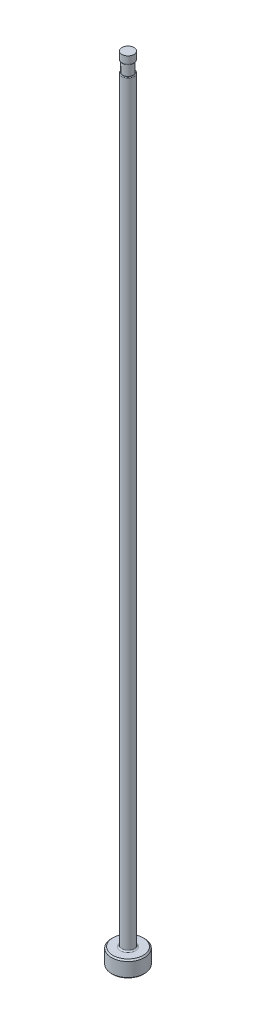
SolidWorks part; units mm, degrees
ref_plane "Front Plane" through (0, 0, 0) normal (0, 0, 1) x (1, 0, 0)
ref_plane "Top Plane" through (0, 0, 0) normal (0, 1, 0) x (1, 0, 0)
ref_plane "Right Plane" through (0, 0, 0) normal (1, 0, 0) x (0, 0, -1)
other "Configuration Table"
sketch "Sketch1" plane through (0, 0, 0) normal (0, 0, 1) x (1, 0, 0)
  line L0 (0, 259.9588) -> (0, -15.1925) construction
  line L1 (0, 0) -> (-3.175, 0)
  line L2 (-3.175, 0) -> (-3.175, 3.175)
  line L3 (-3.175, 3.175) -> (-1.19, 3.175)
  line L4 (-1.19, 3.175) -> (-1.19, 152.4)
  line L5 (-1.19, 152.4) -> (0, 152.4)
  line L6 (0, 152.4) -> (0, 0)
  dimension "L" = 152.4
  dimension "H" = 6.35
  dimension "T" = 3.175
  dimension "D" = 2.38
revolve "Revolve1" add sketch "Sketch1" angle 360 about L0
chamfer "Chamfer1" distance 0.254 angle 45 2 edges at (0, 3.175, 3.175) (0, 0, 3.175)
fillet "Fillet1" radius 0.254 1 edges at (0, 3.175, 1.19)
sketch "Sketch2" plane through (0, 0, 0) normal (0, 0, 1) x (1, 0, 0)
  line L0 (-1.19, 152.4) -> (-1.19, 3.429) construction
  line L1 (-1.19, 150.876) -> (-0.9868, 150.876)
  line L2 (-1.19, 150.876) -> (-1.19, 148.844)
  line L3 (-1.19, 148.844) -> (-0.9868, 148.844)
  line L4 (-0.9868, 150.876) -> (-0.9868, 148.844)
  line L5 (1.19, 152.4) -> (-1.19, 152.4) construction
  line L6 (0, 153.4483) -> (0, 147.3282) construction
  dimension "D1" = 2.032
  dimension "N" = 1.524
  dimension "FD" = 0.2032
  dimension "D3" = 1.9736
revolve "Vent Relief" cut sketch "Sketch2" angle 360 about L6
sketch "Sketch3" plane through (0, 0, 0) normal (0, 0, 1) x (1, 0, 0)
  line L0 (-0.9868, 149.86) -> (-0.9868, 86.36)
  line L1 (-0.9868, 150.876) -> (-0.9868, 148.844) construction
  line L2 (-1.19, 148.844) -> (-1.19, 3.429) construction
  line L3 (-1.19, 85.2424) -> (-1.19, 149.86)
  line L4 (-1.19, 149.86) -> (-0.9868, 149.86)
  arc A0 (-0.9868, 86.36) -> (-1.19, 85.2424) centre (-4.1618, 86.36) cw
  dimension "D1" = 3.175
  dimension "D2" = 63.5
extrude "D-Slot" cut sketch "Sketch3" against normal through all both and the other way through all
sketch "Sketch5" plane through (0, 0, 0) normal (0, 0, 1) x (1, 0, 0)
  line L0 (-1.19, 150.876) -> (1.19, 150.876) construction
  line L1 (-1.19, 152.4) -> (-1.1646, 152.4)
  line L2 (-1.19, 152.4) -> (-1.19, 150.876)
  line L3 (-1.19, 150.876) -> (-1.1646, 150.876)
  line L4 (-1.1646, 152.4) -> (-1.1646, 150.876)
  line L5 (0, 152.6877) -> (0, 150.5771) construction
  dimension "VP" = 0.0254
revolve "Vent Diameter" cut sketch "Sketch5" angle 360 about L5
fillet "Fillet2" radius 0.127 2 edges at (1.19, 148.844, 0) (0, 150.876, 1.1646)
sketch "Pocket Sketch" plane through (0, 0, 0) normal (0, 0, 1) x (1, 0, 0)
  line L0 (-3.5719, 0) -> (-3.5719, 3.2004)
  line L1 (-3.5719, 3.2004) -> (-2.1504, 3.2004)
  line L2 (-1.3884, 3.9624) -> (-1.3884, 22.225)
  line L3 (-1.3884, 22.225) -> (0, 22.225)
  line L4 (0, 22.225) -> (0, 0)
  line L5 (0, 0) -> (-3.5719, 0)
  line L6 (0, 12.6104) -> (0, -2.4989) construction
  line L7 (-3.175, 2.921) -> (-3.175, 0.254) construction
  line L8 (2.921, 3.175) -> (-2.921, 3.175) construction
  line L9 (-1.19, 85.2424) -> (-1.19, 3.429) construction
  line L10 (-2.1504, 3.2004) -> (-1.3884, 3.9624)
  point P3 (-1.3884, 3.2004)
  dimension "D1" = 7.1437
  dimension "D2" = 0.3969
  dimension "D3" = 0.0254
  dimension "D4" = 0.1984
  dimension "D5" = 2.7769
  dimension "D6" = 22.225
